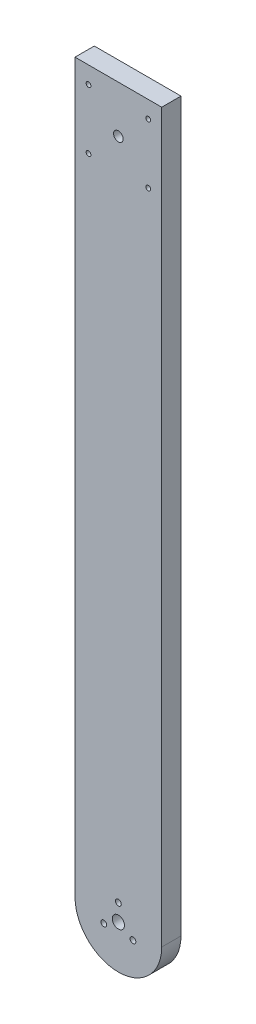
SolidWorks part; units mm, degrees
ref_plane "Front Plane" through (0, 0, 0) normal (0, 0, 1) x (1, 0, 0)
ref_plane "Top Plane" through (0, 0, 0) normal (0, 1, 0) x (1, 0, 0)
ref_plane "Right Plane" through (0, 0, 0) normal (1, 0, 0) x (0, 0, -1)
sketch "Sketch1" plane through (0, 0, 0) normal (0, 0, 1) x (1, 0, 0)
  line L0 (0, -1565.9861) -> (0, 76733.3209) construction
  line L1 (-22.5, 130) -> (22.5, 130)
  line L2 (-22.5, 130) -> (-22.5, -247.5)
  line L4 (22.5, 130) -> (22.5, -247.5)
  line L5 (-22.5, 130) -> (29.4093, -169.9204) construction
  line L6 (-22.5, -130) -> (22.5, 130) construction
  line L7 (-1565.9861, 0) -> (76733.3209, 0) construction
  line L8 (-42.7696, 105.6639) -> (42.7696, 105.6639) construction
  line L9 (-21.1, 126.7639) -> (21.1, 126.7639) construction
  line L10 (-21.1, 126.7639) -> (-21.1, 84.5639) construction
  line L11 (-21.1, 84.5639) -> (21.1, 84.5639) construction
  line L12 (21.1, 126.7639) -> (21.1, 84.5639) construction
  line L13 (-21.1, 126.7639) -> (21.1, 84.5639) construction
  line L14 (-21.1, 84.5639) -> (21.1, 126.7639) construction
  circle A0 centre (-15.5, 121.1639) radius 1.25
  circle A1 centre (15.5, 121.1639) radius 1.25
  circle A2 centre (15.5, 90.1639) radius 1.25
  circle A3 centre (-15.5, 90.1639) radius 1.25
  circle A4 centre (0, 105.6639) radius 2.5
  circle A5 centre (0, -247.5) radius 8.75 construction
  arc A6 (-22.5, -247.5) -> (22.5, -247.5) centre (0, -247.5) ccw
  circle A7 centre (0, -238.75) radius 1.5
  circle A8 centre (7.5777, -251.875) radius 1.5
  circle A9 centre (-7.5777, -251.875) radius 1.5
  circle A10 centre (0, -247.5) radius 3.15
  point P0 (0, 0)
  point P9 (0, 105.6639)
  point P20 (0, 105.6639)
  point P28 (0, 83.0234)
  point P40 (0, -270)
  point P44 (0, -247.5)
  point P46 (0, -107.5)
  point P49 (0, -147.5)
  dimension "D4" = 2.5
  dimension "D6" = 5
  dimension "D9" = 17.5
  dimension "D10" = 3
  dimension "D12" = 6.3
  dimension "D1" = 45
  dimension "D2" = 400
  dimension "D3" = 42.2
  dimension "D5" = 31
  dimension "D7" = 3
extrude "Boss-Extrude1" add sketch "Sketch1" along normal blind 10
